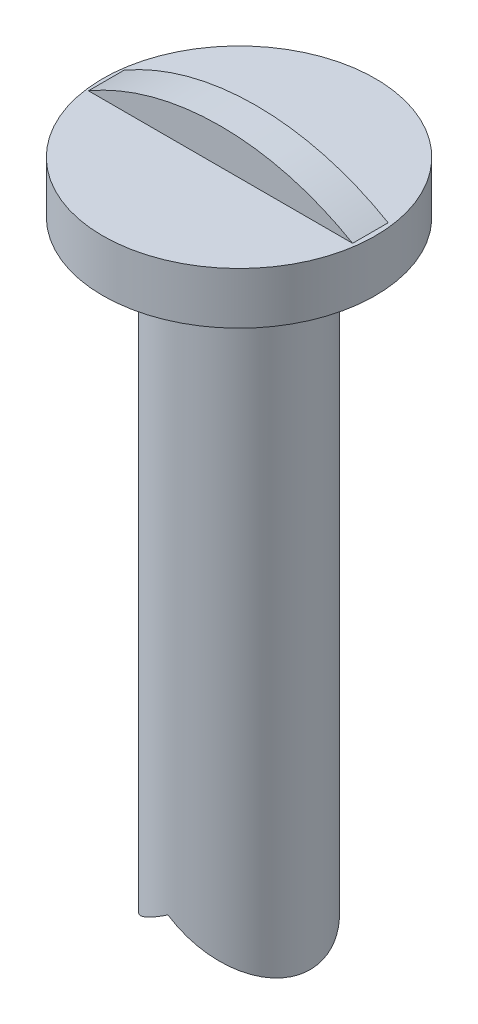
SolidWorks part; units mm, degrees
ref_plane "Plane1" through (0, 0, 0) normal (0, 0, 1) x (1, 0, 0)
ref_plane "Plane2" through (0, 0, 0) normal (0, 1, 0) x (1, 0, 0)
ref_plane "Plane3" through (0, 0, 0) normal (1, 0, 0) x (0, 0, -1)
sketch "Esquisse1" plane through (0, 0, 0) normal (0, 0, 1) x (1, 0, 0)
  line L0 (11.5, 56.3631) -> (11.5, 52)
  line L1 (11.5, 52) -> (6, 52)
  line L2 (6, 52) -> (6, 0)
  line L3 (6, 0) -> (0, 0)
  line L4 (0, 116.5439) -> (0, -39.6962) construction
  line L5 (0, 56.3631) -> (0, 0)
  line L6 (11.5, 56.3631) -> (0, 56.3631)
  dimension "D1" = 6
  dimension "D2" = 11.5
  dimension "D3" = 52
revolve "Base-Révolution" add sketch "Esquisse1" angle 360 about L4
sketch "Esquisse2" plane through (0, 0, 0) normal (0, 0, 1) x (1, 0, 0)
  line L2 (11.5, 56.3631) -> (-11.5, 56.3631) construction
  arc A0 (-11.2094, 56.3631) -> (11.079, 56.3631) centre (-0.0652, 37.1643) cw
  dimension "D1" = 3
rib "Nervure3" sketch "Esquisse2" sketch "Esquisse2" thickness 3 extrusion direction parallel to sketch draft on no parameters "D1"=3
sketch "Esquisse4" plane through (0, 0, 0) normal (0, 0, 1) x (1, 0, 0)
  line L0 (-6, 0) -> (0, 4)
  line L1 (-6, 0) -> (6, 0) construction
  line L2 (0, 116.5439) -> (0, -39.6962) construction
  line L3 (0, 4) -> (6, 0)
  line L4 (-6, 0) -> (6, 0)
  dimension "D1" = 4
  dimension "D2" = 6
  dimension "D3" = 6
extrude "Enlèv. mat.-Extru.1" cut sketch "Esquisse4" against normal mid plane 13
